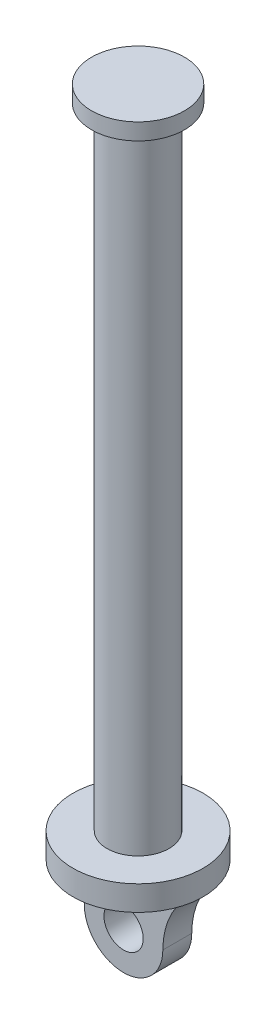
SolidWorks part; units mm, degrees
ref_plane "Front Plane" through (0, 0, 0) normal (0, 0, 1) x (1, 0, 0)
ref_plane "Top Plane" through (0, 0, 0) normal (0, 1, 0) x (1, 0, 0)
ref_plane "Right Plane" through (0, 0, 0) normal (1, 0, 0) x (0, 0, -1)
sketch "Sketch2" plane through (0, 0, 0) normal (0, 1, 0) x (1, 0, 0)
  circle A0 centre (0, 0) radius 22.5
  dimension "D1" = 45
extrude "Boss-Extrude1" add sketch "Sketch2" against normal blind 8
sketch "Sketch3" plane through (0, -8, 0) normal (0, -1, 0) x (1, 0, 0)
  circle A0 centre (0, 0) radius 15
  dimension "D1" = 30
extrude "Boss-Extrude2" add sketch "Sketch3" along normal blind 305
sketch "Sketch4" plane through (0, -313, 0) normal (0, -1, 0) x (1, 0, 0)
  circle A0 centre (0, 0) radius 31.5
  dimension "D1" = 63
extrude "Boss-Extrude3" add sketch "Sketch4" along normal blind 12
sketch "Sketch5" plane through (0, 0, 0) normal (0, 0, 1) x (1, 0, 0)
  line L2 (-31.5, -325) -> (31.5, -325) construction
  line L3 (0, -350) -> (0, 0) construction
  line L4 (-28.5, -325) -> (28.5, -325)
  circle A0 centre (0, -350) radius 9.5
  arc A1 (-19, -350) -> (19, -350) centre (0, -350) ccw
  arc A2 (-19, -350) -> (-28.5, -325) centre (-56.6447, -350) ccw
  arc A3 (28.5, -325) -> (19, -350) centre (56.6447, -350) ccw
  dimension "D2" = 38
  dimension "D3" = 19
  dimension "D1" = 25
  dimension "D4" = 57
  dimension "D5" = 28.5
extrude "Boss-Extrude4" add sketch "Sketch5" along normal mid plane 14
